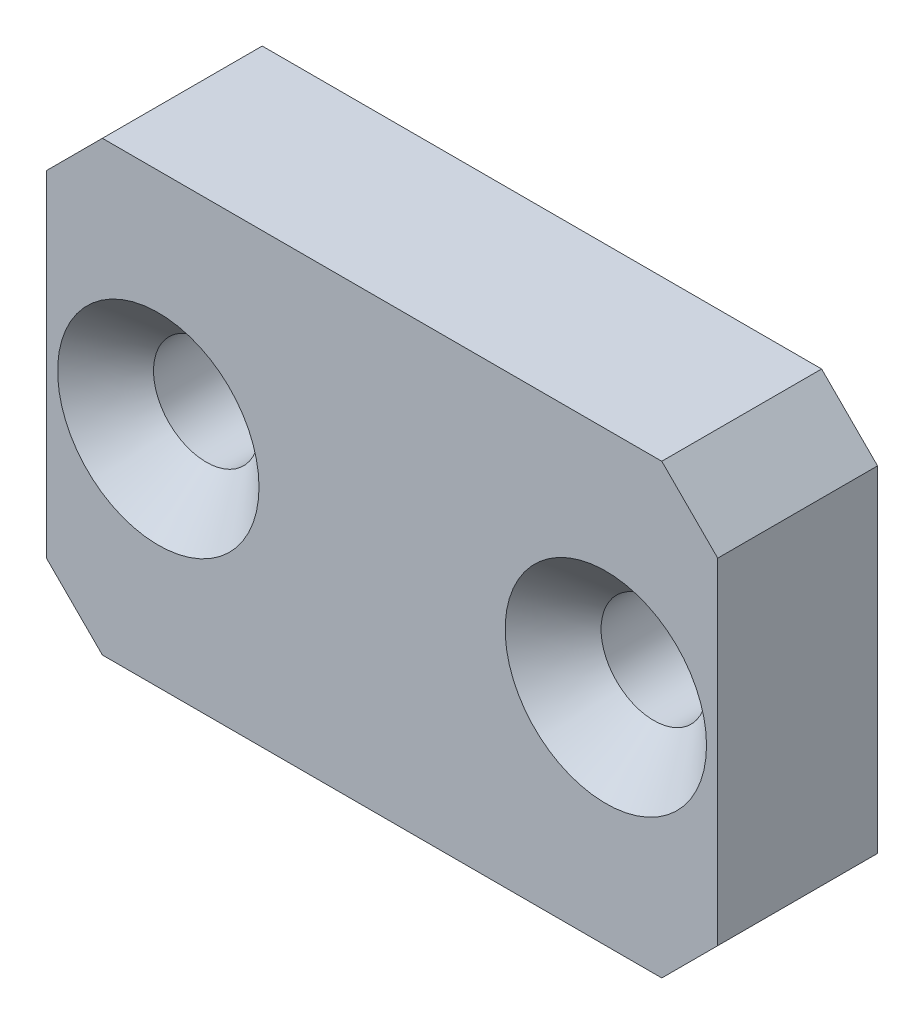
SolidWorks part; units mm, degrees
ref_plane "Plan de face" through (0, 0, 0) normal (0, 0, 1) x (1, 0, 0)
ref_plane "Plan de dessus" through (0, 0, 0) normal (0, 1, 0) x (1, 0, 0)
ref_plane "Plan de droite" through (0, 0, 0) normal (1, 0, 0) x (0, 0, -1)
sketch "Esquisse1" plane through (0, 0, 0) normal (0, 0, 1) x (1, 0, 0)
  line L1 (-21, 14) -> (21, 14)
  line L2 (-21, 14) -> (-21, -14)
  line L3 (-21, -14) -> (21, -14)
  line L4 (21, 14) -> (21, -14)
  point P4 (0, 14)
  point P6 (-21, 0)
  dimension "D1" = 42
  dimension "D2" = 28
extrude "Extrusion1" add sketch "Esquisse1" along normal blind 10
hole_wizard "Fraisage pour vis à tête fraisée M61" positions "Esquisse3" profile "Esquisse2" countersink size "M6" standard "Ansi Métrique"
sketch "Esquisse3" plane through (0, 0, 10) normal (0, 0, 1) x (1, 0, 0)
  line L0 (0, 0) -> (0, -20.72) construction
  point P0 (-14, 0)
  point P1 (14, 0)
  dimension "D1" = 28
sketch "Esquisse2" plane through (-14, 0, 10) normal (1, 0, 0) x (0, -1, 0)
  line L0 (0, 0) -> (0, 10)
  line L1 (0, 10) -> (3.3, 10)
  line L2 (3.3, 10) -> (3.3, 3)
  line L3 (3.3, 3) -> (6.3, 0)
  line L5 (6.3, 0) -> (0, 0)
  line L6 (-3.3, 3) -> (-6.3, 0) construction
  line L11 (0, -6.35) -> (0, 107.95) construction
  dimension "Diamètre du perçage jusqu'au prochain" = 6.6
  dimension "Profondeur du perçage jusqu'au prochain" = 10
  dimension "Diamètre du fraisage entrant" = 12.6
  dimension "Angle du fraisage entrant" = 90
chamfer "Chanfrein1" distance 3.5 angle 45
sketch "Esquisse4" [suppressed] plane through (0, 0, 10) normal (0, 0, 1) x (1, 0, 0)
  line L8 (21, -10.5) -> (21, 10.5)
  line L9 (21, 10.5) -> (17.5, 14)
  line L10 (17.5, 14) -> (-17.5, 14)
  line L11 (-17.5, 14) -> (-21, 10.5)
  line L12 (-21, 10.5) -> (-21, -10.5)
  line L13 (-21, -10.5) -> (-17.5, -14)
  line L14 (-17.5, -14) -> (17.5, -14)
  line L15 (17.5, -14) -> (21, -10.5)
  line L16 (21, -14) -> (21, 14)
  line L18 (21, 14) -> (-21, 14)
  line L20 (-21, 14) -> (-21, -14)
  line L22 (-21, -14) -> (21, -14)
  dimension "D1" = 0
extrude "Boss.-Extru.1" [suppressed] add sketch "Esquisse4" against normal blind 10
